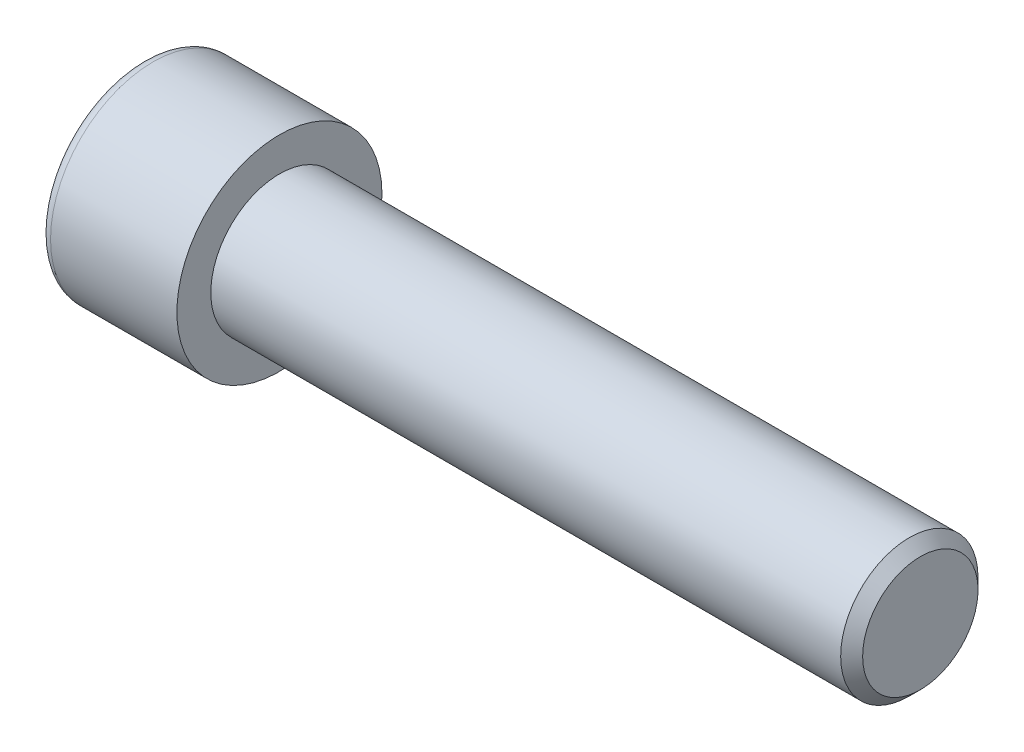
SolidWorks part; units mm, degrees
ref_plane "Front Plane" through (0, 0, 0) normal (0, 0, 1) x (1, 0, 0)
ref_plane "Top Plane" through (0, 0, 0) normal (0, 1, 0) x (1, 0, 0)
ref_plane "Right Plane" through (0, 0, 0) normal (1, 0, 0) x (0, 0, -1)
sketch "Sketch1" plane through (0, 0, 0) normal (0, 0, 1) x (1, 0, 0)
  line L0 (0, 0) -> (53.975, 0)
  line L1 (53.975, 0) -> (53.975, 4.7625)
  line L2 (53.975, 4.7625) -> (9.525, 4.7625)
  line L3 (9.525, 4.7625) -> (9.525, 7.112)
  line L4 (9.525, 7.112) -> (0, 7.112)
  line L5 (0, 7.112) -> (0, 0)
  line L6 (0, 0) -> (-5.4758, 0) construction
  dimension "D1" = 14.224
  dimension "D2" = 9.525
  dimension "D3" = 44.45
  dimension "D4" = 9.525
revolve "Revolve1" add sketch "Sketch1" angle 360 about L6
chamfer "Chamfer1" distance 0.762 angle 45 1 edges at (53.975, 0, -4.7625)
fillet "Fillet1" radius 0.762 1 edges at (0, 0, -7.112)
sketch "Sketch2" plane through (0, 0, 0) normal (-1, 0, 0) x (0, 0, 1)
  line L1 (-2.2877, -3.9624) -> (2.2877, -3.9624)
  line L2 (2.2877, -3.9624) -> (4.5754, 0)
  line L3 (4.5754, 0) -> (2.2877, 3.9624)
  line L4 (2.2877, 3.9624) -> (-2.2877, 3.9624)
  line L5 (-2.2877, 3.9624) -> (-4.5754, 0)
  line L6 (-4.5754, 0) -> (-2.2877, -3.9624)
  circle A0 centre (0, 0) radius 3.9624 construction
  dimension "D1" = 7.9248
extrude "Cut-Extrude1" cut sketch "Sketch2" against normal blind 5.08
